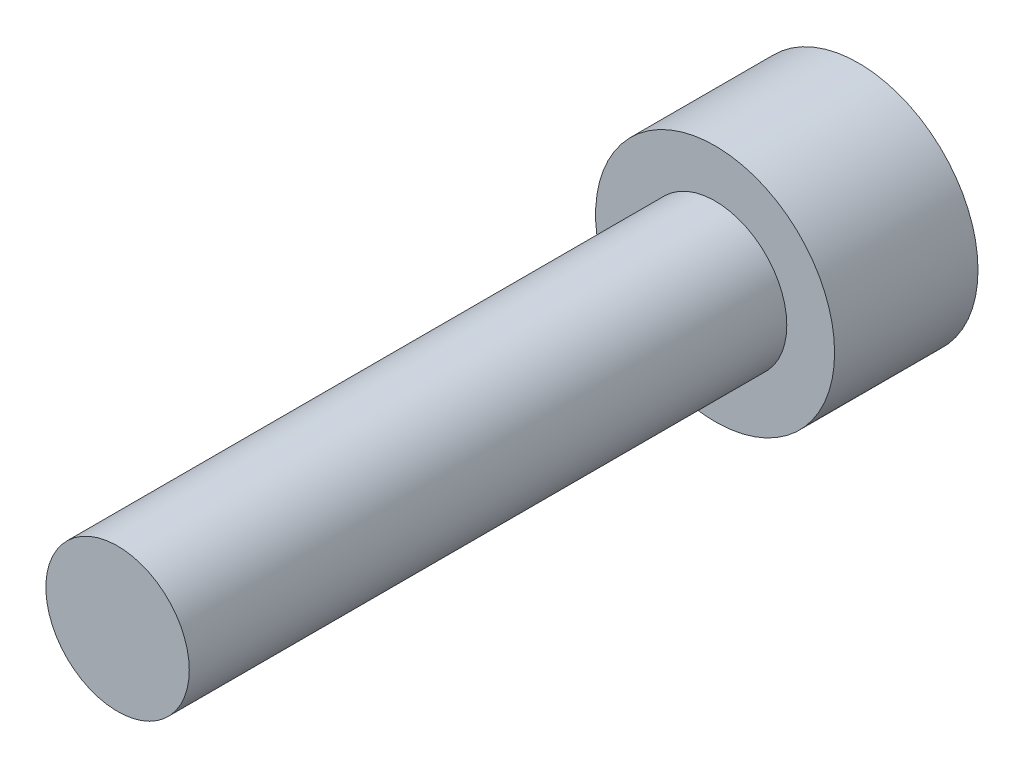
SolidWorks part; units mm, degrees
ref_plane "Front Plane" through (0, 0, 0) normal (0, 0, 1) x (1, 0, 0)
ref_plane "Top Plane" through (0, 0, 0) normal (0, 1, 0) x (1, 0, 0)
ref_plane "Right Plane" through (0, 0, 0) normal (1, 0, 0) x (0, 0, -1)
sketch "Sketch6" plane through (0, 0, 0) normal (1, 0, 0) x (0, 0, -1)
  line L0 (-25, 0) -> (22.525, 0) construction
  line L1 (5.5, 0) -> (-5.5, 0) construction
  line L2 (-25, 0) -> (-25, -3)
  line L3 (-25, -3) -> (0, -3)
  line L4 (0, 5.5) -> (0, -5.5) construction
  line L5 (0, -3) -> (0, -5)
  line L6 (0, -5) -> (6, -5)
  line L7 (6, -5) -> (6, 0)
  line L8 (6, 0) -> (-25, 0)
  dimension "L" = 25
  dimension "H" = 6
  dimension "A" = 10
  dimension "D" = 6
revolve "Revolve1" add sketch "Sketch6" angle 360 about L0
sketch "Sketch7" plane through (0, 0, -6) normal (0, 0, -1) x (-1, 0, 0)
  line L2 (-2.5, 1.4434) -> (-2.5, -1.4434)
  line L4 (-2.5, -1.4434) -> (0, -2.8868)
  line L5 (0, -2.8868) -> (2.5, -1.4434)
  line L6 (2.5, -1.4434) -> (2.5, 1.4434)
  line L7 (2.5, 1.4434) -> (0, 2.8868)
  line L8 (0, 2.8868) -> (-2.5, 1.4434)
  circle A0 centre (0, 0) radius 2.5 construction
  dimension "J" = 5
extrude "HEX" cut sketch "Sketch7" against normal blind 5
